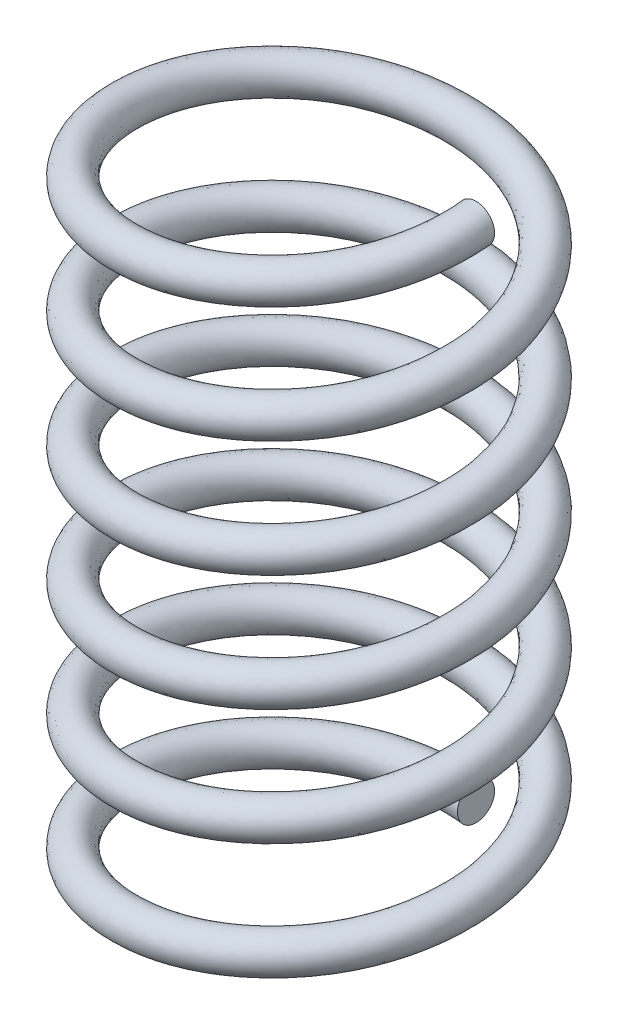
SolidWorks part; units mm, degrees
ref_plane "前视基准面" through (0, 0, 0) normal (0, 0, 1) x (1, 0, 0)
ref_plane "上视基准面" through (0, 0, 0) normal (0, 1, 0) x (1, 0, 0)
ref_plane "右视基准面" through (0, 0, 0) normal (1, 0, 0) x (0, 0, -1)
other "Configuration Table"
sketch "草图2" plane through (0, 0, 0) normal (0, 0, 1) x (1, 0, 0)
  line L0 (0, 0) -> (0, 90)
  dimension "D1" = 90
sketch "草图4" plane through (0, 0, 0) normal (1, 0, 0) x (0, 0, -1)
  circle A0 centre (22.5, 0) radius 2.5
  dimension "D1" = 5
  dimension "D2" = 22.5
sweep "扫描1" add profiles "草图4" path "草图2" parameters "D4"=2070
